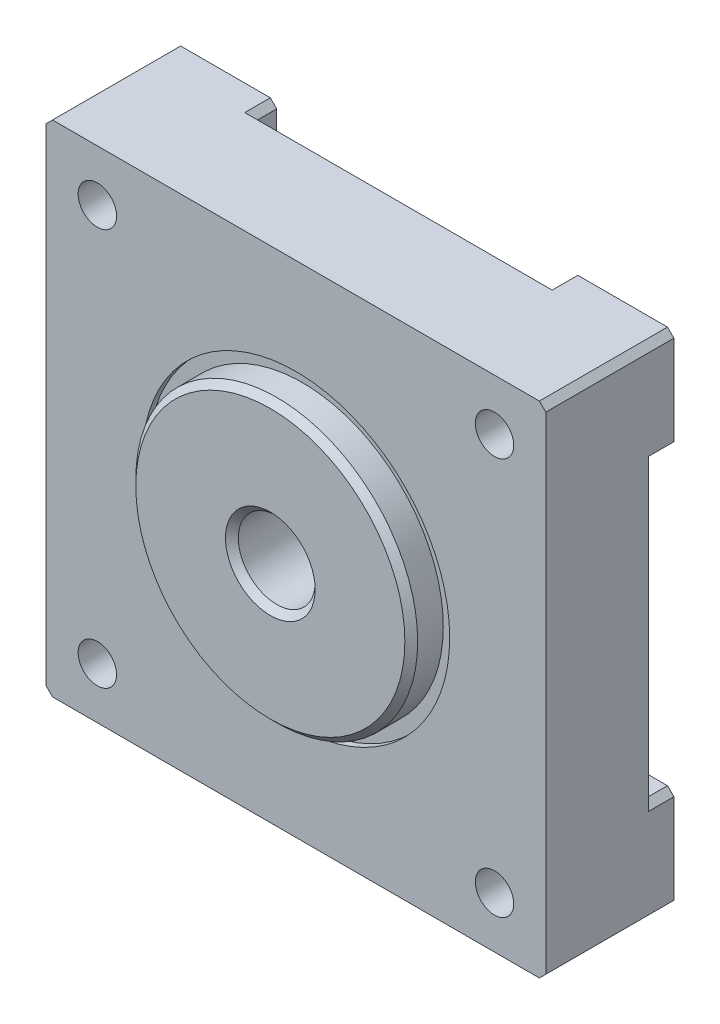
SolidWorks part; units mm, degrees
ref_plane "前视基准面" through (0, 0, 0) normal (0, 0, 1) x (1, 0, 0)
ref_plane "上视基准面" through (0, 0, 0) normal (0, 1, 0) x (1, 0, 0)
ref_plane "右视基准面" through (0, 0, 0) normal (1, 0, 0) x (0, 0, -1)
sketch "草图2" plane through (0, 0, 0) normal (0, 0, 1) x (1, 0, 0)
  line L0 (-19, 19.5) -> (-19.5, 19)
  line L1 (19, 19.5) -> (-19, 19.5)
  line L2 (19.5, 19) -> (19.5, -19)
  line L3 (19, -19.5) -> (-19, -19.5)
  line L4 (-19.5, 19) -> (-19.5, -19)
  line L5 (19.5, 19.5) -> (-19.5, -19.5) construction
  line L6 (19.5, -19.5) -> (-19.5, 19.5) construction
  line L7 (-19.5, -19) -> (-19, -19.5)
  line L8 (19.5, -19) -> (19, -19.5)
  line L9 (19.5, 19) -> (19, 19.5)
  line L10 (-32.8552, 0) -> (42.8961, 0) construction
  line L11 (0, 30.6332) -> (0, -30.2051) construction
  point P0 (0, 0)
  dimension "D1" = 39
  dimension "D2" = 39
extrude "凸台-拉伸1" add sketch "草图2" along normal blind 10
sketch "草图3" plane through (0, 0, 10) normal (0, 0, 1) x (1, 0, 0)
  line L0 (-23.1248, 0) -> (24.4711, 0) construction
  line L1 (0, 25.2599) -> (0, -22.637) construction
  line L2 (-15.5, 15.5) -> (15.5, 15.5) construction
  line L3 (19.5, -19.5) -> (-19.5, -19.5) construction
  line L4 (19.5, -19.5) -> (19.5, 19.5) construction
  line L5 (19.5, 19.5) -> (-19.5, 19.5) construction
  line L6 (-19.5, -19.5) -> (-19.5, 19.5) construction
  line L7 (19.5, -19.5) -> (-19.5, 19.5) construction
  line L8 (19.5, 19.5) -> (-19.5, -19.5) construction
  line L9 (-15.5, -15.5) -> (15.5, -15.5) construction
  circle A0 centre (-15.5, 15.5) radius 1.5 construction
  circle A1 centre (-15.5, -15.5) radius 1.5 construction
  circle A2 centre (15.5, -15.5) radius 1.5 construction
  circle A3 centre (15.5, 15.5) radius 1.5 construction
  circle A4 centre (0, 0) radius 11
  point P5 (0, 0)
  dimension "D4" = 3
  dimension "D5" = 22
  dimension "D1" = 39
  dimension "D2" = 39
  dimension "D3" = 31
extrude "凸台-拉伸2" add sketch "草图3" along normal blind 2
sketch "草图4" plane through (0, 0, 10) normal (0, 0, 1) x (1, 0, 0)
  circle A0 centre (0, 0) radius 11
  circle A1 centre (0, 0) radius 12
  dimension "D1" = 22
  dimension "D2" = 24
extrude "切除-拉伸1" cut sketch "草图4" against normal blind 0.5
sketch "草图5" plane through (0, 0, 12) normal (0, 0, 1) x (1, 0, 0)
  circle A0 centre (0, 0) radius 2.75
  dimension "D1" = 5.5
extrude "切除-拉伸2" cut sketch "草图5" against normal through all
sketch "草图6" plane through (0, 0, 10) normal (0, 0, 1) x (1, 0, 0)
  line L0 (-15.5, 15.5) -> (15.5, 15.5) construction
  line L1 (19.5, -19.5) -> (-19.5, -19.5) construction
  line L2 (19.5, -19.5) -> (19.5, 19.5) construction
  line L3 (19.5, 19.5) -> (-19.5, 19.5) construction
  line L4 (-19.5, -19.5) -> (-19.5, 19.5) construction
  line L5 (19.5, -19.5) -> (-19.5, 19.5) construction
  line L6 (19.5, 19.5) -> (-19.5, -19.5) construction
  line L7 (-22.0953, 0) -> (23.8376, 0) construction
  line L8 (0, -20.7886) -> (0, 29.6414) construction
  line L9 (-15.5, -15.5) -> (15.5, -15.5) construction
  circle A0 centre (-15.5, 15.5) radius 1.5
  circle A1 centre (15.5, 15.5) radius 1.5
  circle A2 centre (15.5, -15.5) radius 1.5
  circle A3 centre (-15.5, -15.5) radius 1.5
  point P0 (0, 0)
  point P1 (0, 0)
  dimension "D4" = 3
  dimension "D1" = 39
  dimension "D2" = 39
  dimension "D3" = 31
extrude "切除-拉伸3" cut sketch "草图6" against normal through all
sketch "草图7" plane through (0, 0, 0) normal (0, 0, -1) x (-1, 0, 0)
  line L0 (-23.1248, 0) -> (24.7879, 0) construction
  line L1 (0, 23.2072) -> (0, -23.0932) construction
  line L2 (-11.5, 11.5) -> (26.0433, -26.0433) construction
  line L3 (20.7812, 20.7812) -> (-21.8179, -21.8179) construction
  line L4 (-19.5, 19.5) -> (-11.5, 11.5) construction
  line L5 (-11.5, 11.5) -> (-11.5, 19.5)
  line L6 (-11.5, 11.5) -> (-19.5, 11.5)
  line L7 (11.5, 11.5) -> (19.5, 11.5)
  line L8 (19, 19.5) -> (-19, 19.5)
  line L9 (-19, 19.5) -> (-19.5, 19)
  line L10 (-19.5, 19) -> (-19.5, -19)
  line L11 (-19.5, -19) -> (-19, -19.5)
  line L12 (-19, -19.5) -> (19, -19.5)
  line L13 (19, -19.5) -> (19.5, -19)
  line L14 (19.5, -19) -> (19.5, 19)
  line L15 (19.5, 19) -> (19, 19.5)
  line L16 (19, 19.5) -> (-19, 19.5)
  line L17 (-19, 19.5) -> (-19.5, 19)
  line L18 (-19.5, 19) -> (-19.5, -19)
  line L19 (-19.5, -19) -> (-19, -19.5)
  line L20 (-19, -19.5) -> (19, -19.5)
  line L21 (19, -19.5) -> (19.5, -19)
  line L22 (19.5, -19) -> (19.5, 19)
  line L23 (19.5, 19) -> (19, 19.5)
  line L24 (11.5, 11.5) -> (11.5, 19.5)
  line L25 (11.5, -11.5) -> (19.5, -11.5)
  line L26 (11.5, -11.5) -> (11.5, -19.5)
  line L27 (-11.5, -11.5) -> (-19.5, -11.5)
  line L28 (-11.5, -11.5) -> (-11.5, -19.5)
  point P17 (-15.5, 15.5)
  dimension "D2" = 45
  dimension "D1" = 0
extrude "切除-拉伸4" cut sketch "草图7" against normal blind 2
chamfer "倒角1" distance 0.5 angle 45 12 edges at (-19.5, -11.5, 1) (-11.5, -11.5, 1) (-11.5, -19.5, 1) (11.5, -19.5, 1) (11.5, -11.5, 1) (19.5, -11.5, 1) (-19.5, 11.5, 1) (-11.5, 11.5, 1) (-11.5, 19.5, 1) (11.5, 19.5, 1) (19.5, 11.5, 1) (11.5, 11.5, 1)
sketch "草图8" plane through (0, 0, 12) normal (0, 0, 1) x (1, 0, 0)
  circle A0 centre (0, 0) radius 3
  dimension "D1" = 6
extrude "切除-拉伸5" cut sketch "草图8" against normal through all
chamfer "倒角2" distance 0.5 angle 45 2 edges at (-3, 0, 2) (3, 0, 12)
chamfer "倒角3" distance 0.5 angle 45 1 edges at (11, 0, 12)
